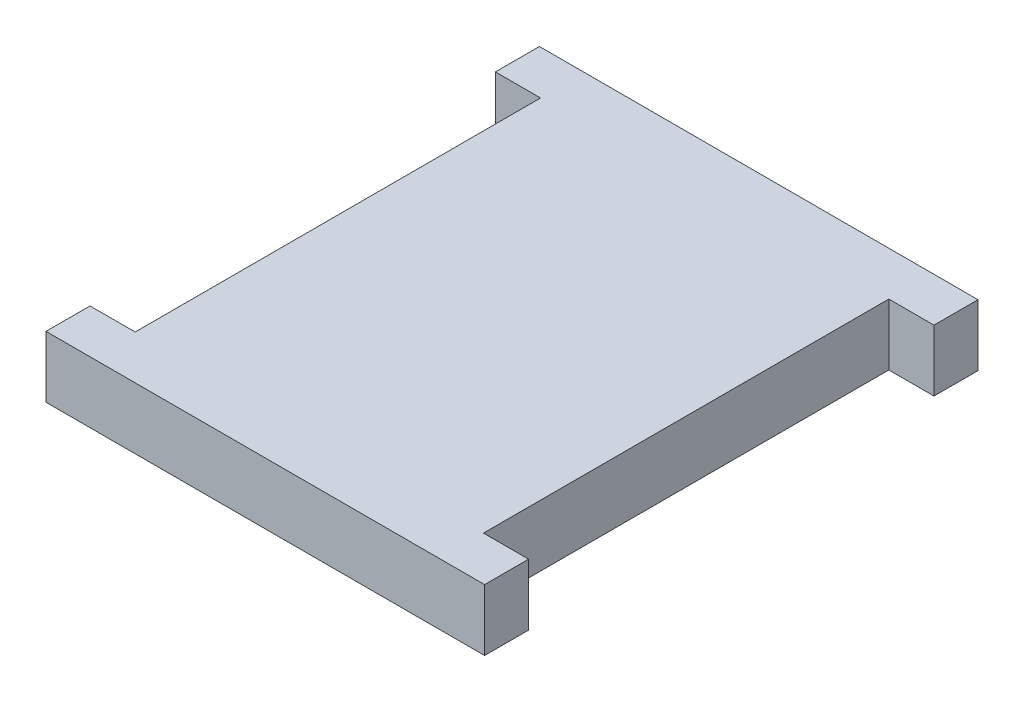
SolidWorks part; units mm, degrees
ref_plane "Front Plane" through (0, 0, 0) normal (0, 0, 1) x (1, 0, 0)
ref_plane "Top Plane" through (0, 0, 0) normal (0, 1, 0) x (1, 0, 0)
ref_plane "Right Plane" through (0, 0, 0) normal (1, 0, 0) x (0, 0, -1)
sketch "Sketch1" plane through (0, 0, 0) normal (0, 1, 0) x (1, 0, 0)
  line L0 (-68, 62.85) -> (-54, 62.85)
  line L1 (-68, -76.5) -> (68, -76.5)
  line L2 (-68, -76.5) -> (-68, -62.85)
  line L3 (-68, 76.5) -> (68, 76.5)
  line L4 (68, -76.5) -> (68, -62.85)
  line L5 (-68, -76.5) -> (68, 76.5) construction
  line L6 (-68, 76.5) -> (68, -76.5) construction
  line L7 (-54, 62.85) -> (-54, -62.85)
  line L8 (-54, -62.85) -> (-68, -62.85)
  line L9 (68, 62.85) -> (54, 62.85)
  line L10 (54, 62.85) -> (54, -62.85)
  line L11 (54, -62.85) -> (68, -62.85)
  line L12 (54, 0) -> (-54, 0) construction
  line L13 (-54, 0) -> (-68, 0) construction
  line L14 (54, 0) -> (68, 0) construction
  line L15 (-68, -62.85) -> (-68, 0) construction
  line L16 (-68, 62.85) -> (-68, 76.5)
  line L17 (-68, 0) -> (-68, 62.85) construction
  line L18 (68, 0) -> (68, 62.85) construction
  line L19 (68, 62.85) -> (68, 76.5)
  line L20 (68, -62.85) -> (68, 0) construction
  point P0 (0, 0)
  point P16 (54, 63.8911)
  dimension "D1" = 153
  dimension "D2" = 136
  dimension "D3" = 125.7
  dimension "D4" = 108
extrude "Boss-Extrude1" add sketch "Sketch1" along normal mid plane 19.05
